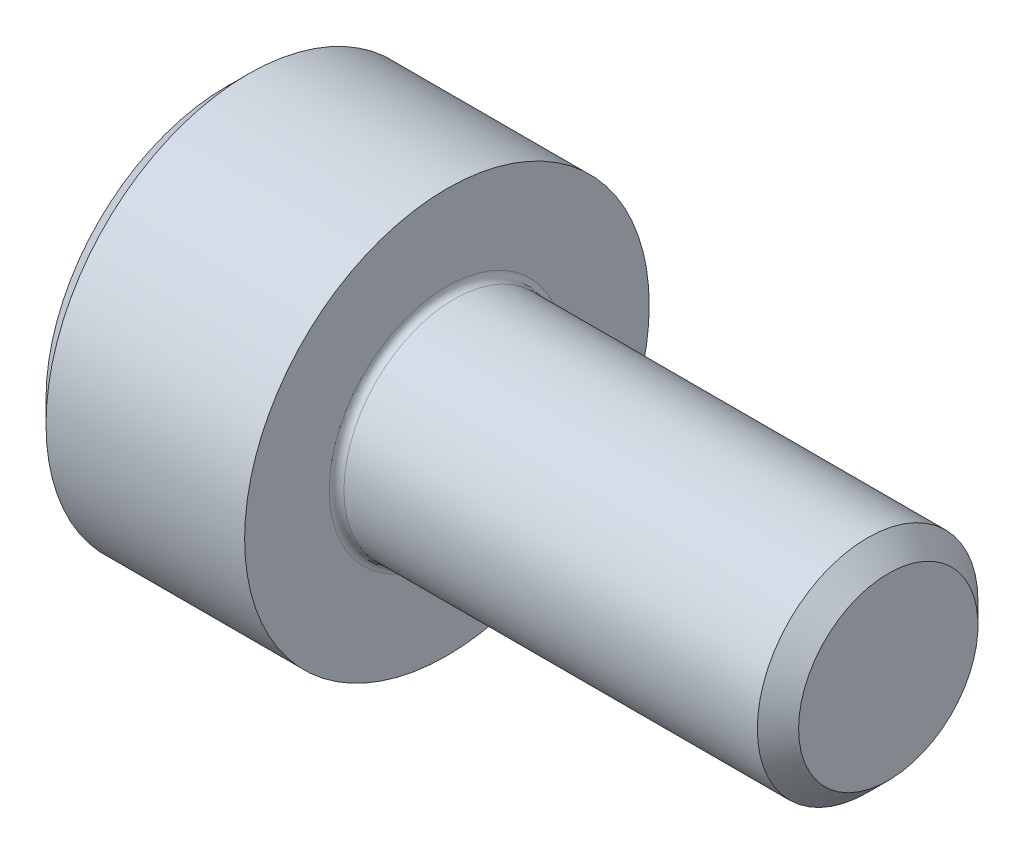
SolidWorks part; units mm, degrees
ref_plane "Plane1" through (0, 0, 0) normal (0, 0, 1) x (1, 0, 0)
ref_plane "Plane2" through (0, 0, 0) normal (0, 1, 0) x (1, 0, 0)
ref_plane "Plane3" through (0, 0, 0) normal (1, 0, 0) x (0, 0, -1)
sketch "BodySke" plane through (0, 0, 0) normal (0, 0, 1) x (1, 0, 0)
  line L0 (0, 0) -> (0, 2.45)
  line L1 (0.3, 2.75) -> (3, 2.75)
  line L2 (3, 2.75) -> (3, 1.5)
  line L3 (3, 1.5) -> (8.7195, 1.5)
  line L4 (9, 1.2195) -> (9, 0)
  line L5 (9, 0) -> (0, 0)
  line L6 (-31.75, 0) -> (127, 0) construction
  line L7 (0, 2.45) -> (0.3, 2.75)
  line L8 (9, 1.2195) -> (8.7195, 1.5)
  line L9 (0, -2.45) -> (0.3, -2.75) construction
  line L10 (9, -1.2195) -> (8.7195, -1.5) construction
  line L11 (3.5, 9.525) -> (3.5, 3.175) construction
  line L12 (3, 9.525) -> (3, 3.175) construction
  line L13 (-41, 9.525) -> (-41, 3.175) construction
  dimension "Diameter" = 3
  dimension "Head_ht" = 3
  dimension "Length" = 6
  dimension "Body_ch_ang" = 45
  dimension "Head_dia" = 5.5
  dimension "Head_ch_ang" = 45
  dimension "Minor_dia" = 2.439
  dimension "Advance" = 0.5
  dimension "Thread_nom" = 6
  dimension "Thread_length" = 50
  dimension "Head_ch_ht" = 0.3
revolve "Base-Revolve" add sketch "BodySke"
fillet "Fillet1" radius 0.1 1 edges at (3, 0, 1.5)
sketch "Sketch2" plane through (0, 0, 0) normal (0, 0, 1) x (1, 0, 0)
  line L0 (0, 1.28) -> (1.3, 1.28)
  line L1 (1.3, 1.28) -> (2.039, 0)
  line L2 (-31.75, 0) -> (127, 0) construction
  line L3 (2.039, 0) -> (0, 0)
  line L4 (0, 0) -> (0, 1.28)
  line L5 (0, 2.45) -> (0, -2.45) construction
  line L6 (0, 0) -> (47.625, 0) construction
  line L7 (3, -2.75) -> (3, 2.75) construction
  dimension "D1" = 1.28
  dimension "D2" = 60
  dimension "Wall_thickness" = 1.7
revolve "Hex-PreBroach" cut sketch "Sketch2" angle 360 about L6
sketch "Sketch3" plane through (0, 0, 0) normal (-1, 0, 0) x (0, 0.5, 0.866)
  line L0 (0.739, 1.28) -> (-0.739, 1.28)
  line L1 (-0.739, 1.28) -> (-1.478, 0)
  line L2 (0.739, 1.28) -> (1.478, 0)
  line L3 (0.739, -1.28) -> (1.478, 0)
  line L4 (0.739, -1.28) -> (-0.739, -1.28)
  line L5 (-0.739, -1.28) -> (-1.478, 0)
  dimension "D1" = 1.28
  dimension "D2" = 1.28
  dimension "Hex_size" = 2.56
extrude "Hex" cut sketch "Sketch3" against normal blind 1.3
sketch "Sketch4" plane through (0, 0, 0) normal (-1, 0, 0) x (0, 0, 1)
  line L0 (0, 0) -> (1.4605, 0)
  line L1 (0, 0) -> (6.1484, 3.5498) construction
  line L2 (0, 0) -> (0.7302, 1.2648)
  line L3 (1.2009, 0.3267) -> (1.3933, 0.4378)
  line L4 (0.8834, 0.8767) -> (1.0758, 0.9877)
  arc A0 (1.2009, 0.3267) -> (0.8834, 0.8767) centre (0, 0) ccw
  arc A1 (1.4605, 0) -> (1.3933, 0.4378) centre (0, 0) ccw
  arc A2 (0.7302, 1.2648) -> (1.0758, 0.9877) centre (0, 0) cw
  dimension "D1" = 30
  dimension "Spline_n_dim" = 2.4892
  dimension "Spline_m_dim" = 2.921
  dimension "D2" = 60
  dimension "D3" = 0.3175
  dimension "Spline_p_dim" = 0.635
extrude "Spline" [suppressed] cut sketch "Sketch4" against normal blind 1.3
pattern_circular "CirPattern1" [suppressed] count 6 every 60
sketch "Sketch5" plane through (0, 0, 0) normal (0, 0, 1) x (1, 0, 0)
  line L0 (-31.75, 0) -> (127, 0) construction
  line L2 (0, 2.45) -> (0, -2.45) construction
  circle A0 centre (1.2, 0) radius 0.475
  dimension "Drilled_hole_dia" = 0.95
  dimension "Drilled_hole_loc" = 1.2
extrude "Hole" [suppressed] cut sketch "Sketch5" against normal through all and the other way through all
pattern_circular "Drilled-4" [suppressed] count 2 every 60
pattern_circular "Drilled-6" [suppressed] count 3 every 60
sketch "ThdSchSke" plane through (0, 0, 0) normal (0, 0, 1) x (1, 0, 0)
  line L0 (3.5, -1.2195) -> (3.3036, -1.5)
  line L1 (3.5, -1.2195) -> (3.6964, -1.5)
  line L2 (3.6964, -1.5) -> (3.6964, -1.875)
  line L3 (-3.175, 0) -> (5.1513, 0) construction
  line L5 (3.6964, -1.875) -> (3.3036, -1.875)
  line L6 (3.3036, -1.875) -> (3.3036, -1.5)
  line L7 (0, 2.45) -> (0, -2.45) construction
  dimension "Thread_minor" = 2.439
  dimension "Diameter" = 3
  dimension "Start" = 3.5
  dimension "SideAngle" = 55
  dimension "VeeAngle" = 70
  dimension "Overcut" = 3.75
revolve "ThreadSchematic" [suppressed] cut sketch "ThdSchSke" angle 360 about L3
pattern_linear "ThdSchPat" [suppressed]
equation "\"D2@Sketch3\" = \"Hex_size@Sketch3\" / 2"
equation "\"D1@Sketch3\" = \"Hex_size@Sketch3\" / 2"
equation "\"D1@Sketch2\" = \"Hex_size@Sketch3\" / 2"
equation "\"D3@Sketch4\" = \"Spline_p_dim@Sketch4\" / 2"
equation "\"Thread_minor@ThreadCosmetic\"  =  \"Minor_dia@BodySke\""
equation "\"D2@CirPattern1\" = 360 / \"Num_teeth@CirPattern1\""
equation "\"Wall_thickness@Sketch2\" = \"Head_ht@BodySke\" - \"Key_eng@Hex\""
equation "\"Thread_length@ThreadCosmetic\" = ((sgn( (\"Length@BodySke\" - \"Advance@BodySke\" ) - \"Thread_nom@BodySke\" )-1)*( (\"Length@BodySke\" - \"Advance@BodySke\" ) - \"Thread_nom@BodySke\" ))/-2+ \"Thread_nom@BodySke\""
equation "\"Thread_minor@ThdSchSke\" = \"Minor_dia@BodySke\""
equation "\"Diameter@ThdSchSke\" = \"Diameter@BodySke\""
equation "\"Overcut@ThdSchSke\" = \"Diameter@BodySke\" * 1.25"
equation "\"Start@ThdSchSke\" = \"Head_ht@BodySke\" + \"Length@BodySke\" - \"Thread_length@ThreadCosmetic\"  '---Non-countersunk---"
equation "\"Num_threads@ThdSchPat\" = int( \"Thread_length@ThreadCosmetic\" / \"Advance@BodySke\" + 0.999 )  + 1"
equation "\"Advance@ThdSchPat\" = \"Thread_length@ThreadCosmetic\" /  (\"Num_threads@ThdSchPat\" - 1) 'relax it"
equation "\"Num_threads@ThdSchPat\" = \"Num_threads@ThdSchPat\" - sgn( \"Num_threads@ThdSchPat\" - 1) '---chamfered tips only---"
